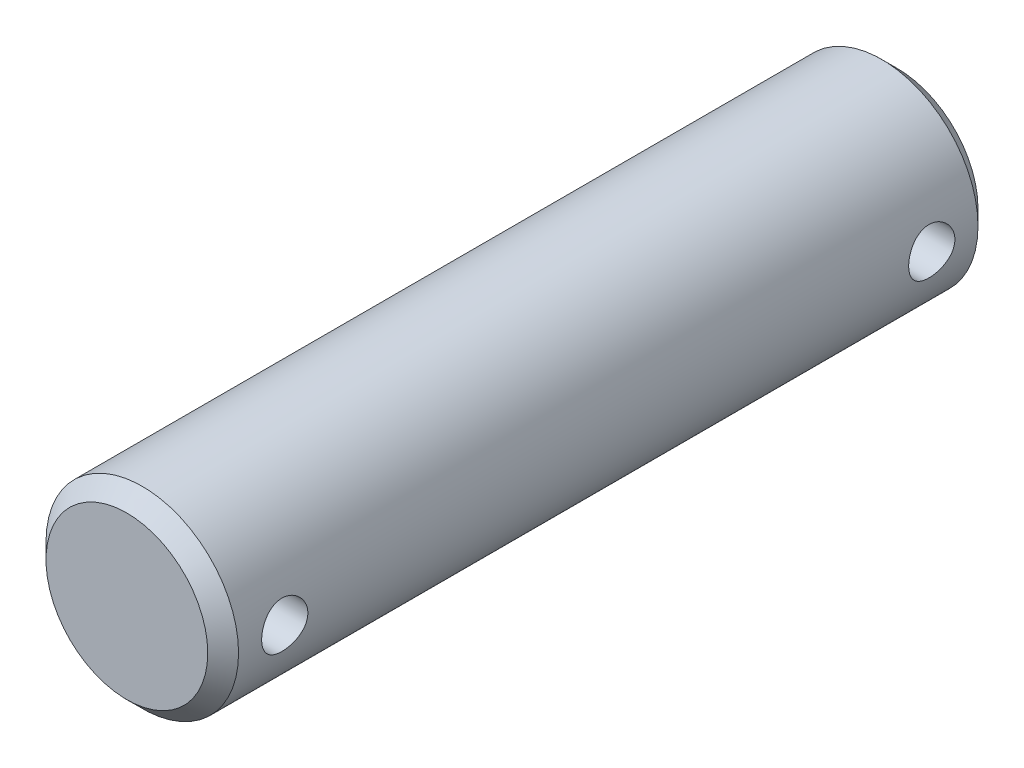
SolidWorks part; units mm, degrees
ref_plane "Face" through (0, 0, 0) normal (0, 0, 1) x (1, 0, 0)
ref_plane "Dessus" through (0, 0, 0) normal (0, 1, 0) x (1, 0, 0)
ref_plane "Droite" through (0, 0, 0) normal (1, 0, 0) x (0, 0, -1)
sketch "Esquisse1" plane through (0, 0, 0) normal (0, 0, 1) x (1, 0, 0)
  circle A0 centre (0, 0) radius 12.5
  dimension "D1" = 25
extrude "Base-Extrusion" add sketch "Esquisse1" along normal blind 100
chamfer "Chanfrein1" distance 2 angle 45
sketch "Esquisse2" plane through (0, 0, 0) normal (1, 0, 0) x (0, 0, -1)
  line L0 (-98, 0) -> (-2, 0) construction
  line L1 (0, -10.5) -> (0, 10.5) construction
  line L2 (-100, 10.5) -> (-100, -10.5) construction
  circle A0 centre (-8, 0) radius 3
  circle A1 centre (-92, 0) radius 3
  dimension "D1" = 6
  dimension "D2" = 8
  dimension "D3" = 8
extrude "Enlèv. mat.-Extru.1" cut sketch "Esquisse2" against normal mid plane 28
